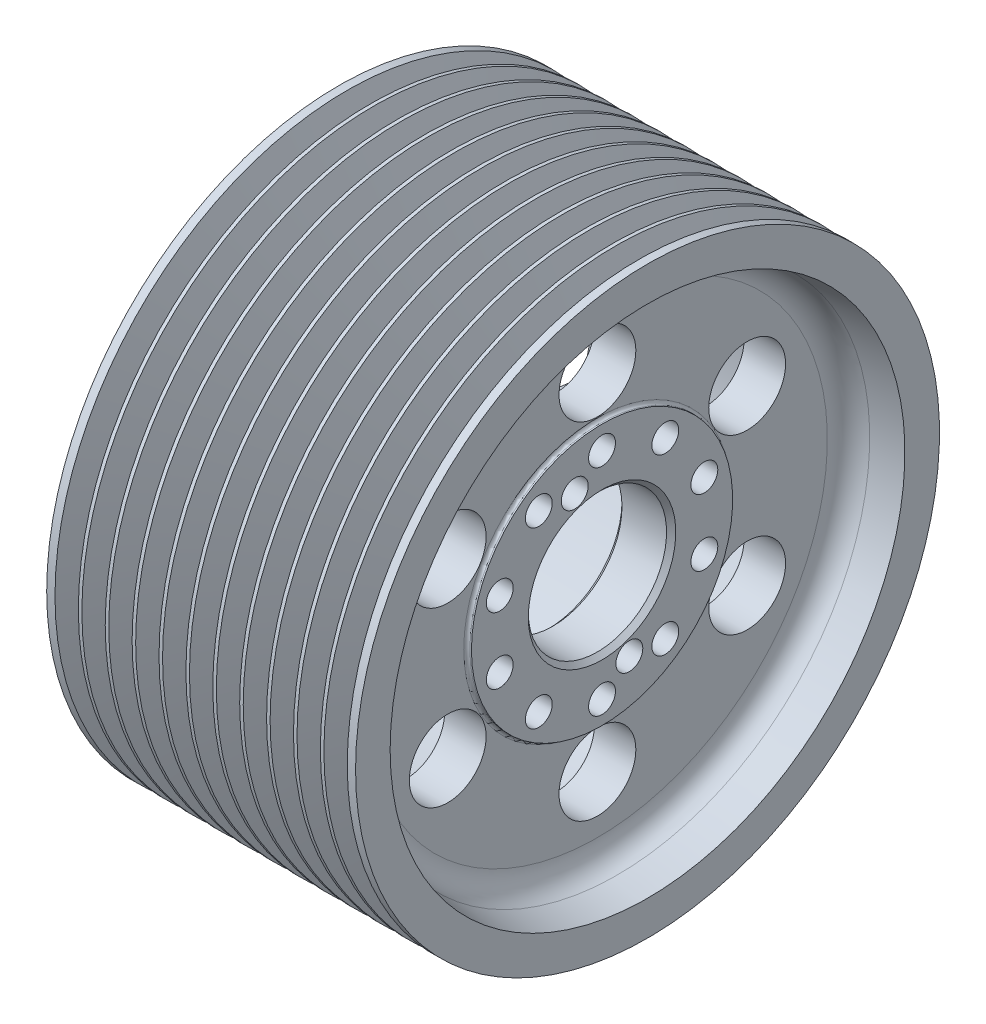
SolidWorks part; units mm, degrees
ref_plane "Ebene vorne" through (0, 0, 0) normal (0, 0, 1) x (1, 0, 0)
ref_plane "Ebene oben" through (0, 0, 0) normal (0, 1, 0) x (1, 0, 0)
ref_plane "Ebene rechts" through (0, 0, 0) normal (1, 0, 0) x (0, 0, -1)
sketch "Skizze1" plane through (0, 0, 0) normal (0, 0, 1) x (1, 0, 0)
  line L0 (0, 0) -> (99.6343, 0) construction
  line L1 (0, 167.5) -> (0, 190)
  line L2 (0, 190) -> (201, 190)
  line L3 (201, 190) -> (201, 167.5)
  line L4 (201, 167.5) -> (181.126, 164.4518)
  line L5 (168.4, 149.6252) -> (168.4, 87)
  line L6 (170.4, 85) -> (171.4, 85)
  line L7 (171.4, 85) -> (171.4, 45)
  line L8 (171.4, 45) -> (136.4, 45)
  line L9 (136.4, 45) -> (136.4, 85)
  line L10 (126.8605, 162.9465) -> (60, 165)
  line L11 (0, 167.5) -> (60, 167.5)
  line L12 (60, 167.5) -> (60, 165)
  line L13 (136.4, 85) -> (139.4, 85)
  line L14 (141.4, 87) -> (141.4, 147.9536)
  arc A0 (141.4, 147.9536) -> (126.8605, 162.9465) centre (126.4, 147.9536) ccw
  arc A1 (141.4, 87) -> (139.4, 85) centre (139.4, 87) cw
  arc A2 (170.4, 85) -> (168.4, 87) centre (170.4, 87) cw
  arc A3 (181.126, 164.4518) -> (168.4, 149.6252) centre (183.4, 149.6252) ccw
  point P17 (141.4, 162.5)
  point P26 (168.4, 162.5)
  dimension "D14" = 15
  dimension "D16" = 2
  dimension "D17" = 2
  dimension "D19" = 15
  dimension "D1" = 380
  dimension "D2" = 201
  dimension "D3" = 90
  dimension "D4" = 325
  dimension "D5" = 170
  dimension "D6" = 325
  dimension "D7" = 60
  dimension "D8" = 330
  dimension "D9" = 335
  dimension "D10" = 136.4
  dimension "D11" = 27
  dimension "D12" = 35
  dimension "D13" = 335
  dimension "D15" = 5
  dimension "D18" = 170
revolve "Rotation1" add sketch "Skizze1" angle 360 about L0
sketch "Skizze2" plane through (0, 0, 0) normal (0, 0, 1) x (1, 0, 0)
  line L0 (0, 0) -> (234.4632, 0) construction
  line L1 (188, 215.1593) -> (188, 174.8) construction
  line L2 (185.9323, 174.8) -> (190.0677, 174.8)
  line L3 (190.0677, 174.8) -> (195.6, 190)
  line L4 (195.6, 190) -> (180.4, 190)
  line L5 (201, -190) -> (201, 190) construction
  line L6 (201, 190) -> (0, 190) construction
  line L7 (185.9323, 174.8) -> (180.4, 190)
  dimension "D1" = 13
  dimension "D2" = 15.2
  dimension "D3" = 15.2
  dimension "D5" = 7.6
  dimension "D6" = 20
revolve "Schnitt-Rotation1" cut sketch "Skizze2" angle 360 about L0
pattern_linear "Lineares Muster1" count 11 spacing 17.5 along (1, 0, 0) of "Schnitt-Rotation1"
hole_wizard "Ø17.5 (17.5) Durchmesser Bohrung1" positions "Skizze4" profile "Skizze3" hole size "Ø17.5" standard "DIN"
sketch "Skizze4" plane through (171.4, 0, 0) normal (1, 0, 0) x (0, 0, -1)
  line L0 (0, 0) -> (0, 70) construction
  line L2 (0, 0) -> (0, 64.3677) construction
  point P0 (0, 70)
  dimension "D1" = 70
  dimension "D2" = 0
sketch "Skizze3" plane through (171.4, 70, 0) normal (0, 1, 0) x (0, 0, -1)
  line L0 (0, 0) -> (0, 35.001)
  line L1 (0, 35.001) -> (8.75, 35.001)
  line L2 (8.75, 35.001) -> (8.75, 0)
  line L5 (8.75, 0) -> (0, 0)
  line L11 (0, -6.35) -> (0, 107.95) construction
  dimension "Bohrerdurchmesser" = 17.5
  dimension "Bohrungstiefe" = 35.001
pattern_circular "Kreismuster1" count 10 over 360 of "Ø17.5 (17.5) Durchmesser Bohrung1"
sketch "Skizze5" plane through (168.4, 0, 0) normal (1, 0, 0) x (0, 0, -1)
  line L0 (0, 0) -> (0, 112.5) construction
  circle A0 centre (0, 112.5) radius 25
  dimension "D2" = 50
  dimension "D1" = 112.5
extrude "Schnitt-Linear austragen1" cut sketch "Skizze5" against normal up to next
pattern_circular "Kreismuster2" count 6 over 360 of "Schnitt-Linear austragen1"
chamfer "Fase1" distance 3 angle 45
hole_wizard "M16 Gewindebohrung1" positions "Skizze7" profile "Skizze6" tap size "M16" standard "DIN"
sketch "Skizze7" plane through (171.4, 0, 0) normal (1, 0, 0) x (0, 0, -1)
  line L0 (0, 0) -> (-17.7685, 54.6857) construction
  line L2 (0, 0) -> (0, 120) construction
  point P0 (-17.7685, 54.6857)
  dimension "D1" = 57.5
  dimension "D2" = 18
sketch "Skizze6" plane through (171.4, 54.6857, 17.7685) normal (0, 1, 0) x (0, 0, -1)
  line L0 (0, 0) -> (0, 35.001)
  line L1 (0, 35.001) -> (7, 35.001)
  line L2 (7, 35.001) -> (7, 0)
  line L5 (7, 0) -> (0, 0)
  line L11 (0, -6.35) -> (0, 107.95) construction
  dimension "Bohrerdurchmesser" = 14
  dimension "Bohrungstiefe" = 35.001
hole_wizard "Ø17.5 (17.5) Durchmesser Bohrung2" positions "Skizze9" profile "Skizze8" hole size "Ø17.5" standard "DIN"
sketch "Skizze9" plane through (171.4, 0, 0) normal (1, 0, 0) x (0, 0, -1)
  point P0 (-17.7685, 54.6857)
sketch "Skizze8" plane through (171.4, 54.6857, 17.7685) normal (0, 1, 0) x (0, 0, -1)
  line L0 (0, 0) -> (0, 20.2575)
  line L1 (0, 20.2575) -> (8.75, 15)
  line L2 (8.75, 15) -> (8.75, 0)
  line L5 (8.75, 0) -> (0, 0)
  line L10 (0, 20.2575) -> (-8.75, 15) construction
  line L11 (0, -6.35) -> (0, 107.95) construction
  dimension "Bohrerdurchmesser" = 17.5
  dimension "Bohrungstiefe" = 15
  dimension "Spitzenwinkel" = 118
pattern_circular "Kreismuster3" count 2 over 360 of "M16 Gewindebohrung1", "Ø17.5 (17.5) Durchmesser Bohrung2"
fillet "Verrundung1" radius 1
